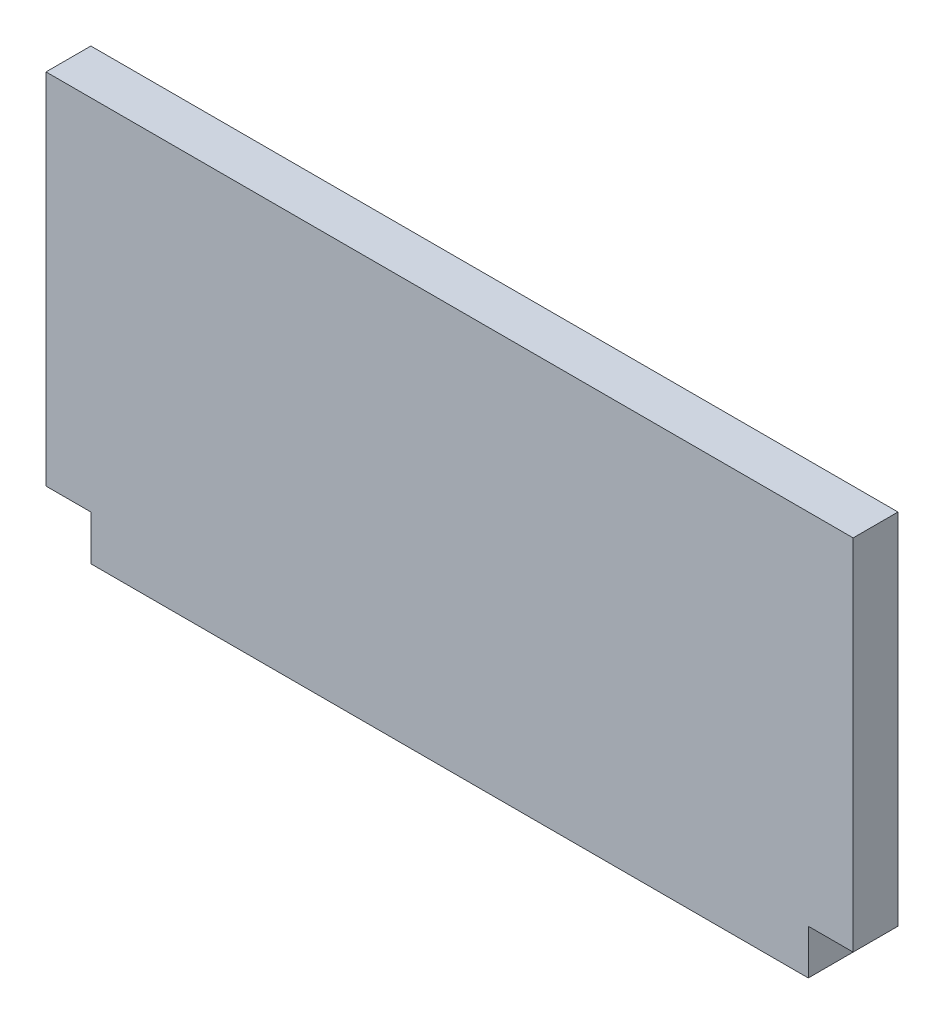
SolidWorks part; units mm, degrees
ref_plane "Front Plane" through (0, 0, 0) normal (0, 0, 1) x (1, 0, 0)
ref_plane "Top Plane" through (0, 0, 0) normal (0, 1, 0) x (1, 0, 0)
ref_plane "Right Plane" through (0, 0, 0) normal (1, 0, 0) x (0, 0, -1)
sketch "Sketch1" plane through (0, 0, 0) normal (0, 0, 1) x (1, 0, 0)
  line L0 (-57.15, -25.4) -> (-57.15, 25.4)
  line L1 (-57.15, -25.4) -> (-50.8, -25.4)
  line L2 (-57.15, 25.4) -> (57.15, 25.4)
  line L3 (57.15, -25.4) -> (57.15, 25.4)
  line L4 (-57.15, -25.4) -> (57.15, 25.4) construction
  line L5 (-57.15, 25.4) -> (57.15, -25.4) construction
  line L6 (0, 25.4) -> (0, -31.75) construction
  line L8 (-50.8, -25.4) -> (-50.8, -31.75)
  line L9 (-50.8, -31.75) -> (50.8, -31.75)
  line L10 (50.8, -25.4) -> (50.8, -31.75)
  line L11 (50.8, -25.4) -> (57.15, -25.4)
  point P1 (0, 0)
  dimension "D1" = 114.3
  dimension "D2" = 50.8
  dimension "D3" = 101.6
  dimension "D4" = 6.35
extrude "Boss-Extrude1" add sketch "Sketch1" along normal blind 6.35
